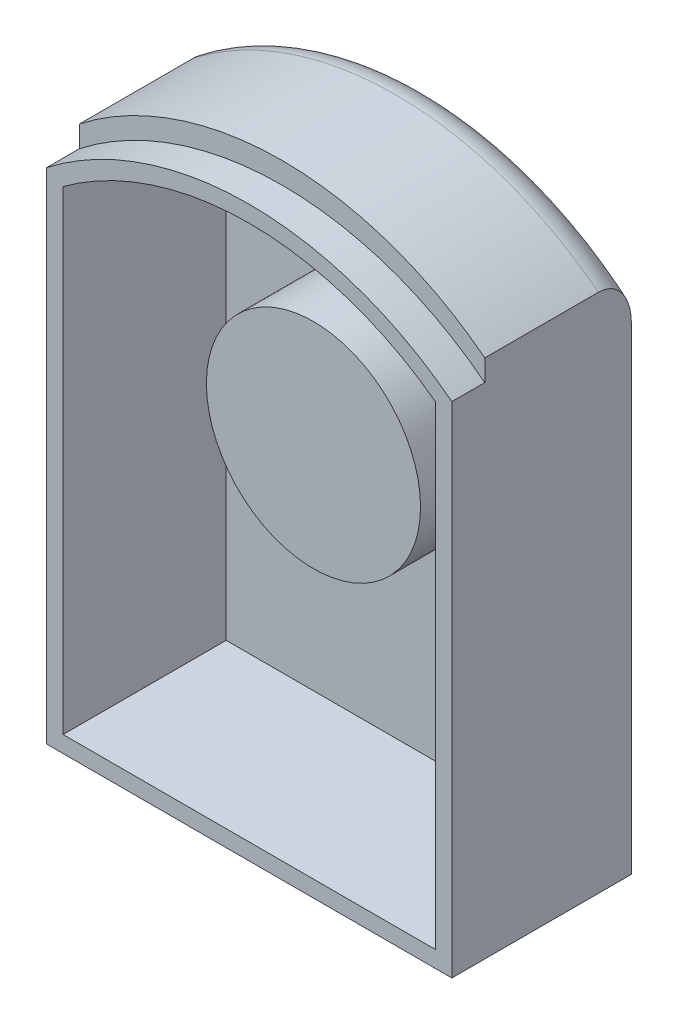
SolidWorks part; units mm, degrees
ref_plane "Front Plane" through (0, 0, 0) normal (0, 0, 1) x (1, 0, 0)
ref_plane "Top Plane" through (0, 0, 0) normal (0, 1, 0) x (1, 0, 0)
ref_plane "Right Plane" through (0, 0, 0) normal (1, 0, 0) x (0, 0, -1)
sketch "Sketch1" plane through (0, 0, 0) normal (0, 0, 1) x (1, 0, 0)
  line L0 (-12.3, 30.3) -> (-12.3, 0)
  line L1 (-12.3, 0) -> (12.3, 0)
  line L2 (12.3, 0) -> (12.3, 30.3)
  arc A0 (-12.3, 30.3) -> (12.3, 30.3) centre (0, 14.5295) cw
  dimension "D3" = 20
  dimension "D1" = 24.6
  dimension "D2" = 30.3
extrude "Boss-Extrude1" add sketch "Sketch1" along normal blind 10
shell "Shell1" thickness 1
sketch "Sketch6" plane through (0, 0, 0) normal (0, 0, -1) x (-1, 0, 0)
  line L0 (-12.3, 30.3) -> (-12.3, 31.6)
  line L1 (12.3, 30.3) -> (12.3, 31.6)
  arc A0 (-12.3, 30.3) -> (12.3, 30.3) centre (0, 14.5295) cw
  arc A1 (-12.3, 31.6) -> (12.3, 31.6) centre (0, 15.8295) cw
  dimension "D1" = 20
  dimension "D2" = 20
  dimension "D3" = 1.3
  dimension "D4" = 1.3
extrude "Boss-Extrude6" add sketch "Sketch6" against normal blind 8
sketch "Sketch7" plane through (0, 0, 0) normal (0, 0, -1) x (-1, 0, 0)
  line L3 (12.3, 0) -> (12.3, 31.6)
  line L4 (-12.3, 31.6) -> (-12.3, 0)
  line L5 (-12.3, 0) -> (12.3, 0)
  line L6 (12.3, 0) -> (12.3, 31.6)
  line L7 (-12.3, 31.6) -> (-12.3, 0)
  line L8 (-12.3, 0) -> (12.3, 0)
  arc A1 (12.3, 31.6) -> (-12.3, 31.6) centre (0, 15.8295) ccw
  arc A4 (12.3, 31.6) -> (-12.3, 31.6) centre (0, 15.8295) ccw
  dimension "D1" = 0
extrude "Boss-Extrude7" add sketch "Sketch7" along normal blind 0.9
sketch "Sketch8" plane through (0, 0, 1) normal (0, 0, 1) x (1, 0, 0)
  line L3 (-11.3, 29.8039) -> (-11.3, 1)
  line L4 (-11.3, 1) -> (11.3, 1)
  line L5 (11.3, 1) -> (11.3, 29.8039)
  line L6 (-11.3, 29.8039) -> (-11.3, 1)
  line L7 (-11.3, 1) -> (11.3, 1)
  line L8 (11.3, 1) -> (11.3, 29.8039)
  arc A1 (11.3, 29.8039) -> (-11.3, 29.8039) centre (0, 14.5295) ccw
  arc A2 (11.3, 29.8039) -> (-11.3, 29.8039) centre (0, 14.5295) ccw
  dimension "D1" = 0
extrude "Cut-Extrude1" cut sketch "Sketch8" against normal blind 0.9
fillet "Fillet1" radius 2 1 edges at (0, 35.8295, -0.9)
sketch "Sketch9" plane through (0, 0, -0.9) normal (0, 0, -1) x (-1, 0, 0)
  line L0 (0, 0) -> (0, 33.8295) construction
  line L1 (-12.25, 19.9147) -> (12.25, 19.9147) construction
  arc A0 (12.3, 28.9714) -> (-12.3, 28.9714) centre (0, 15.8295) ccw construction
  circle A1 centre (0, 19.9147) radius 6.5
  point P9 (0, 16.9147)
  dimension "D1" = 13
  dimension "D2" = 3
extrude "Boss-Extrude8" add sketch "Sketch9" against normal blind 7
sketch "Sketch10" plane through (0, 0, -0.9) normal (0, 0, -1) x (-1, 0, 0)
  line L0 (0, 0) -> (0, 33.8295) construction
  line L1 (-12.25, 19.9147) -> (12.25, 19.9147) construction
  arc A0 (12.3, 28.9714) -> (-12.3, 28.9714) centre (0, 15.8295) ccw construction
  circle A1 centre (0, 19.9147) radius 5.55
  point P8 (0, 16.9147)
  dimension "D1" = 11.1
  dimension "D2" = 3
extrude "Cut-Extrude2" cut sketch "Sketch10" against normal blind 4.2
